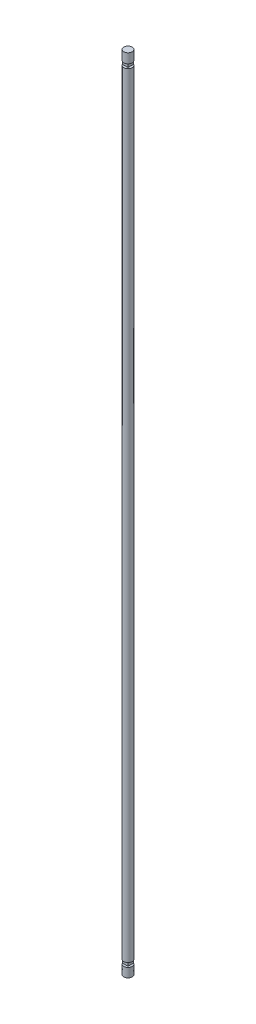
SolidWorks part; units mm, degrees
ref_plane "Front Plane" through (0, 0, 0) normal (0, 0, 1) x (1, 0, 0)
ref_plane "Top Plane" through (0, 0, 0) normal (0, 1, 0) x (1, 0, 0)
ref_plane "Right Plane" through (0, 0, 0) normal (1, 0, 0) x (0, 0, -1)
sketch "Sketch1" plane through (0, 0, 0) normal (0, 1, 0) x (1, 0, 0)
  circle A0 centre (0, 0) radius 4.7625
  dimension "D1" = 9.525
extrude "Extrude1" add sketch "Sketch1" along normal blind 914.4
ref_plane "Plane1" through (0, 0, 4.7625) normal (0, 0, 1) x (1, 0, 0)
sketch "Sketch2" plane through (0, 0, 4.7625) normal (0, 0, 1) x (1, 0, 0)
  line L0 (-4.7625, 0) -> (4.7625, 0) construction
  line L1 (4.7625, 914.4) -> (-4.7625, 914.4) construction
  line L2 (-9.9712, 15.1765) -> (12.8196, 15.1765)
  line L3 (-9.9712, 15.1765) -> (-9.9712, 10.414)
  line L4 (-9.9712, 10.414) -> (12.8196, 10.414)
  line L5 (12.8196, 15.1765) -> (12.8196, 10.414)
  line L6 (-13.4418, 903.478) -> (22.7089, 903.478)
  line L7 (-13.4418, 903.478) -> (-13.4418, 898.7155)
  line L8 (-13.4418, 898.7155) -> (22.7089, 898.7155)
  line L9 (22.7089, 903.478) -> (22.7089, 898.7155)
  dimension "D1" = 4.7625
  dimension "D2" = 10.922
  dimension "D3" = 4.7625
  dimension "D4" = 10.414
extrude "Cut-Extrude1" cut sketch "Sketch2" against normal blind 2.54
ref_plane "Plane2" through (4.7625, 0, 0) normal (1, 0, 0) x (0, 0, -1)
sketch "Sketch3" plane through (4.7625, 0, 0) normal (1, 0, 0) x (0, 0, -1)
  line L0 (4.7625, 914.4) -> (-4.7625, 914.4) construction
  line L1 (-12.0404, 903.478) -> (16.2978, 903.478)
  line L2 (-12.0404, 903.478) -> (-12.0404, 898.7155)
  line L3 (-12.0404, 898.7155) -> (16.2978, 898.7155)
  line L4 (16.2978, 903.478) -> (16.2978, 898.7155)
  line L5 (-8.0295, 10.414) -> (14.1368, 10.414)
  line L6 (-8.0295, 10.414) -> (-8.0295, 15.1765)
  line L7 (-8.0295, 15.1765) -> (14.1368, 15.1765)
  line L8 (14.1368, 10.414) -> (14.1368, 15.1765)
  dimension "D1" = 4.7625
  dimension "D2" = 10.922
extrude "Cut-Extrude2" cut sketch "Sketch3" against normal blind 2.54
